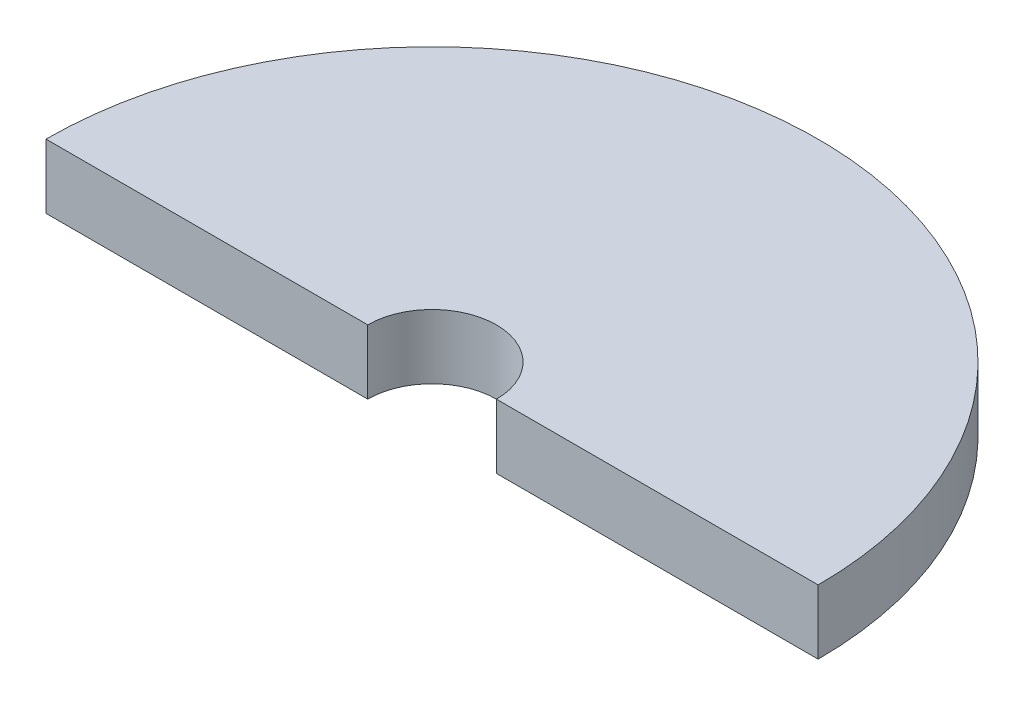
SolidWorks part; units mm, degrees
ref_plane "Face" through (0, 0, 0) normal (0, 0, 1) x (1, 0, 0)
ref_plane "Dessus" through (0, 0, 0) normal (0, 1, 0) x (1, 0, 0)
ref_plane "Droite" through (0, 0, 0) normal (1, 0, 0) x (0, 0, -1)
sketch "Esquisse1" plane through (0, 0, 0) normal (0, 1, 0) x (1, 0, 0)
  circle A0 centre (0, 0) radius 6
  circle A1 centre (0, 0) radius 1
  dimension "D1" = 12
  dimension "D2" = 2
extrude "Extrusion1" add sketch "Esquisse1" along normal blind 1
sketch "Esquisse2" plane through (0, 0, 0) normal (0, 0, 1) x (1, 0, 0)
  line L0 (0, 4.6708) -> (0, 1) construction
  line L1 (0, 0) -> (6, 0)
  line L2 (0, 0) -> (0, 1)
  line L3 (0, 1) -> (6, 1)
  line L4 (6, 0) -> (6, 1)
  line L6 (-6, 0) -> (6, 0) construction
  line L7 (6, 1) -> (-6, 1) construction
revolve "Coupe" cut sketch "Esquisse2" angle 180 about L0
